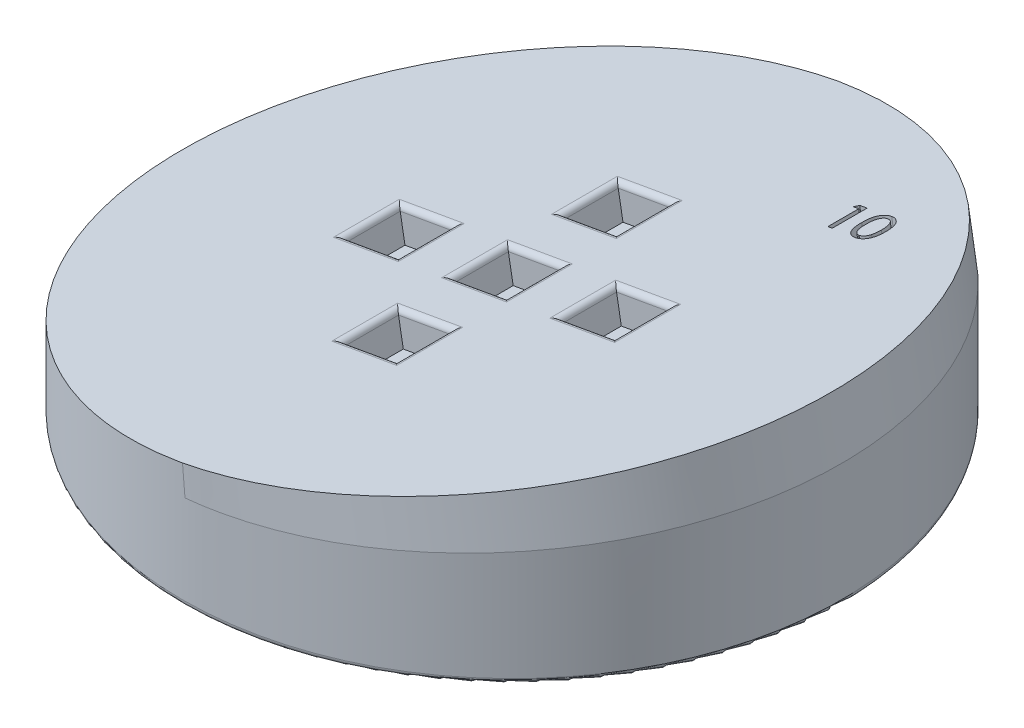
SolidWorks part; units mm, degrees
ref_plane "Front Plane" through (0, 0, 0) normal (0, 0, 1) x (1, 0, 0)
ref_plane "Top Plane" through (0, 0, 0) normal (0, 1, 0) x (1, 0, 0)
ref_plane "Right Plane" through (0, 0, 0) normal (1, 0, 0) x (0, 0, -1)
sketch "Sketch1" plane through (0, 0, 0) normal (0, 1, 0) x (1, 0, 0)
  circle A0 centre (0, 0) radius 30
extrude "Boss-Extrude1" add sketch "Sketch1" along normal blind 50
sketch "Sketch3" plane through (0, 50, 0) normal (0, 1, 0) x (1, 0, 0)
sketch "Sketch4" plane through (0, 0, 0) normal (0, -1, 0) x (-1, 0, 0)
  line L0 (0, 0) -> (-10, 0) construction
  line L1 (0, 0) -> (0, -10) construction
  line L2 (0, 0) -> (0, 10) construction
  line L3 (0, 0) -> (10, 0) construction
  line L5 (-2.5, 2.5) -> (2.5, 2.5)
  line L6 (-2.5, 2.5) -> (-2.5, -2.5)
  line L7 (-2.5, -2.5) -> (2.5, -2.5)
  line L8 (2.5, 2.5) -> (2.5, -2.5)
  line L9 (-2.5, 2.5) -> (2.5, -2.5) construction
  line L10 (-2.5, -2.5) -> (2.5, 2.5) construction
  line L11 (-2.5, -7.5) -> (2.5, -7.5)
  line L12 (-2.5, -7.5) -> (-2.5, -12.5)
  line L13 (-2.5, -12.5) -> (2.5, -12.5)
  line L14 (2.5, -7.5) -> (2.5, -12.5)
  line L15 (-2.5, -7.5) -> (2.5, -12.5) construction
  line L16 (-2.5, -12.5) -> (2.5, -7.5) construction
  line L17 (7.5, 2.5) -> (12.5, 2.5)
  line L18 (7.5, 2.5) -> (7.5, -2.5)
  line L19 (7.5, -2.5) -> (12.5, -2.5)
  line L20 (12.5, 2.5) -> (12.5, -2.5)
  line L21 (7.5, 2.5) -> (12.5, -2.5) construction
  line L22 (7.5, -2.5) -> (12.5, 2.5) construction
  line L23 (-12.5, 2.5) -> (-7.5, 2.5)
  line L24 (-12.5, 2.5) -> (-12.5, -2.5)
  line L25 (-12.5, -2.5) -> (-7.5, -2.5)
  line L26 (-7.5, 2.5) -> (-7.5, -2.5)
  line L27 (-12.5, 2.5) -> (-7.5, -2.5) construction
  line L28 (-12.5, -2.5) -> (-7.5, 2.5) construction
  line L29 (2.5, 7.5) -> (-2.5, 7.5)
  line L30 (2.5, 7.5) -> (2.5, 12.5)
  line L31 (2.5, 12.5) -> (-2.5, 12.5)
  line L32 (-2.5, 7.5) -> (-2.5, 12.5)
  line L33 (2.5, 7.5) -> (-2.5, 12.5) construction
  line L34 (2.5, 12.5) -> (-2.5, 7.5) construction
  dimension "D1" = 5
  dimension "D2" = 5
  dimension "D3" = 5
  dimension "D4" = 5
  dimension "D5" = 5
  dimension "D6" = 5
extrude "Cut-Extrude2" cut sketch "Sketch4" against normal blind 3
fillet "Fillet2" radius 0.5 21 edges at (0, 0, 30) (2.5, 0, 0) (0, 0, 2.5) (-2.5, 0, 0) (0, 0, -2.5) (2.5, 0, 10) (0, 0, 12.5) (-2.5, 0, 10) (0, 0, 7.5) (-7.5, 0, 0) (-10, 0, 2.5) (-12.5, 0, 0) (-10, 0, -2.5) (12.5, 0, 0) (10, 0, 2.5) (7.5, 0, 0) (10, 0, -2.5) (-2.5, 0, -10) (0, 0, -12.5) (2.5, 0, -10) (0, 0, -7.5)
ref_plane "Plane6" through (0, 0, 3.5) normal (0, 0, 1) x (1, 0, 0)
sketch "Sketch13" plane through (0, 0, 3.5) normal (0, 0, 1) x (1, 0, 0)
  line L0 (-30, 6) -> (30, 16.5796)
  line L1 (-30, 50) -> (-30, 0.5) construction
  line L2 (30, 0.5) -> (30, 50) construction
  line L3 (30, 16.5796) -> (30, 50)
  line L4 (30, 50) -> (-30, 50)
  line L5 (-30, 50) -> (-30, 6)
  line L6 (30, 0.5) -> (-30, 0.5) construction
  dimension "D1" = 5.5
  dimension "D2" = 10
extrude "Cut-Extrude10" cut sketch "Sketch13" against normal mid plane 90
ref_plane "Plane4" through (0, 0, -2.5) normal (0, 0, -1) x (-1, 0, 0)
ref_plane "Plane5" through (0, 0, -62.5) normal (0, 0, -1) x (-1, 0, 0)
sketch "Sketch15" plane through (-1.9307, 10.9494, 0) normal (-0.1736, 0.9848, 0) x (0.9848, 0.1736, 0)
  line L0 (-28.5023, 0) -> (0, 0) construction
  line L2 (-6.0023, -2.5) -> (-11.0023, -2.5)
  line L3 (-6.0023, -2.5) -> (-6.0023, 2.5)
  line L4 (-6.0023, 2.5) -> (-11.0023, 2.5)
  line L5 (-11.0023, -2.5) -> (-11.0023, 2.5)
  line L6 (-6.0023, -2.5) -> (-11.0023, 2.5) construction
  line L7 (-6.0023, 2.5) -> (-11.0023, -2.5) construction
  line L8 (3.9977, -2.5) -> (-1.0023, -2.5)
  line L9 (3.9977, -2.5) -> (3.9977, 2.5)
  line L10 (3.9977, 2.5) -> (-1.0023, 2.5)
  line L11 (-1.0023, -2.5) -> (-1.0023, 2.5)
  line L12 (3.9977, -2.5) -> (-1.0023, 2.5) construction
  line L13 (3.9977, 2.5) -> (-1.0023, -2.5) construction
  line L14 (13.9977, -2.5) -> (8.9977, -2.5)
  line L15 (13.9977, -2.5) -> (13.9977, 2.5)
  line L16 (13.9977, 2.5) -> (8.9977, 2.5)
  line L17 (8.9977, -2.5) -> (8.9977, 2.5)
  line L18 (13.9977, -2.5) -> (8.9977, 2.5) construction
  line L19 (13.9977, 2.5) -> (8.9977, -2.5) construction
  line L20 (3.9977, -12.5) -> (-1.0023, -12.5)
  line L21 (3.9977, -12.5) -> (3.9977, -7.5)
  line L22 (3.9977, -7.5) -> (-1.0023, -7.5)
  line L23 (-1.0023, -12.5) -> (-1.0023, -7.5)
  line L24 (3.9977, -12.5) -> (-1.0023, -7.5) construction
  line L25 (3.9977, -7.5) -> (-1.0023, -12.5) construction
  line L26 (3.9977, 7.5) -> (-1.0023, 7.5)
  line L27 (3.9977, 7.5) -> (3.9977, 12.5)
  line L28 (3.9977, 12.5) -> (-1.0023, 12.5)
  line L29 (-1.0023, 7.5) -> (-1.0023, 12.5)
  line L30 (3.9977, 7.5) -> (-1.0023, 12.5) construction
  line L31 (3.9977, 12.5) -> (-1.0023, 7.5) construction
  ellipse E0 centre (1.9605, 0) end of major axis (32.4233, 0) minor radius 30 construction
  point P9 (-8.5023, 0)
  point P14 (1.4977, 0)
  point P19 (11.4977, 0)
  point P24 (1.4977, -10)
  point P29 (1.4977, 10)
  dimension "D1" = 40
  dimension "D2" = 30
  dimension "D3" = 20
  dimension "D4" = 5
  dimension "D5" = 5
  dimension "D6" = 5
  dimension "D7" = 5
  dimension "D8" = 5
  dimension "D9" = 5
  dimension "D10" = 5
  dimension "D11" = 5
  dimension "D12" = 10
  dimension "D13" = 10
  dimension "D14" = 5
  dimension "D15" = 5
extrude "Cut-Extrude11" cut sketch "Sketch15" against normal blind 3
ref_plane "Plane7" through (0, 0, 0) normal (0, 0, -1) x (-1, 0, 0)
sketch "Sketch24" plane through (-1.9307, 10.9494, 0) normal (-0.1736, 0.9848, 0) x (0.9848, 0.1736, 0)
  line L0 (1.4977, -30) -> (35.1643, -35.8499)
  line L1 (1.4977, 0) -> (-28.5023, 0)
  line L3 (35.1643, -35.8499) -> (45.7239, 0)
  line L4 (45.7239, 0) -> (28.8644, 38.5482)
  line L5 (28.8644, 38.5482) -> (1.4977, 34.4662)
  line L6 (1.4977, 34.4662) -> (1.4977, 30)
  arc A0 (1.4977, -30) -> (-28.5023, 0) centre (1.4977, 0) ccw
  ellipse E1 centre (1.9605, 0) end of major axis (-28.5023, 0) minor radius 30 construction
  dimension "D1" = 30
extrude "Cut-Extrude13" cut sketch "Sketch24" against normal blind 100 contours A0 M21
fillet "Fillet8" radius 0.5 4 edges at (-0.4558, 11.2094, -7.5) (2.0063, 11.6436, -10) (-0.4558, 11.2094, -12.5) (-2.9178, 10.7753, -10)
fillet "Fillet9" radius 0.5 4 edges at (9.3923, 12.9459, 2.5) (11.8543, 13.38, 0) (9.3923, 12.9459, -2.5) (6.9303, 12.5118, 0)
fillet "Fillet10" radius 0.5 4 edges at (-12.7659, 9.0388, 0) (-10.3038, 9.473, 2.5) (-7.8418, 9.9071, 0) (-10.3038, 9.473, -2.5)
fillet "Fillet11" radius 0.5 4 edges at (-2.9178, 10.7753, 10) (-0.4558, 11.2094, 12.5) (2.0063, 11.6436, 10) (-0.4558, 11.2094, 7.5)
fillet "Fillet12" radius 0.5 4 edges at (-2.9178, 10.7753, 0) (-0.4558, 11.2094, 2.5) (2.0063, 11.6436, 0) (-0.4558, 11.2094, -2.5)
sketch "Sketch25" plane through (-1.9307, 10.9494, 0) normal (-0.1736, 0.9848, 0) x (0.9848, 0.1736, 0)
  text T0 "<b>10</b>"
extrude "Cut-Extrude14" cut sketch "Sketch25" against normal blind 4
